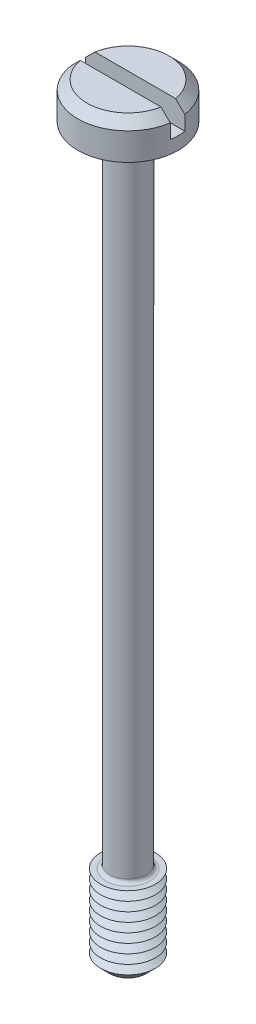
SolidWorks part; units mm, degrees
ref_plane "Front Plane" through (0, 0, 0) normal (0, 0, 1) x (1, 0, 0)
ref_plane "Top Plane" through (0, 0, 0) normal (0, 1, 0) x (1, 0, 0)
ref_plane "Right Plane" through (0, 0, 0) normal (1, 0, 0) x (0, 0, -1)
sketch "Sketch1" plane through (0, 0, 0) normal (0, 1, 0) x (1, 0, 0)
  circle A0 centre (0, 0) radius 2.75
  dimension "D1" = 5.5
extrude "Boss-Extrude1" add sketch "Sketch1" along normal blind 2
sketch "Sketch2" plane through (0, 0, 0) normal (0, -1, 0) x (1, 0, 0)
  circle A0 centre (0, 0) radius 1
  dimension "D1" = 2
extrude "Boss-Extrude2" add sketch "Sketch2" along normal blind 40
sketch "Sketch3" plane through (0, -40, 0) normal (0, -1, 0) x (1, 0, 0)
  circle A0 centre (0, 0) radius 1.5
  dimension "D1" = 3
extrude "Boss-Extrude3" add sketch "Sketch3" against normal blind 4.5
chamfer "Chamfer1" distance 0.5 angle 45 1 edges at (0, -40, -1.5)
sketch "Sketch4" plane through (0, 0, 0) normal (1, 0, 0) x (0, 0, -1)
  line L0 (0, -6.5871) -> (0, -12.0372) construction
sketch "Sketch5" plane through (0, 0, 0) normal (1, 0, 0) x (0, 0, -1)
  line L0 (-1.5, -35.5) -> (-1.067, -35.75)
  line L1 (-1.067, -35.75) -> (-1.5, -36)
  line L2 (-1.5, -35.5) -> (-1.5, -39.5) construction
  line L3 (-1.5, -36) -> (-1.5, -35.5)
  dimension "D1" = 0.5
revolve "Cut-Revolve1" cut sketch "Sketch5" angle 360 about L0
pattern_linear "LPattern1" count 8 spacing 0.5 along (0, -1, 0) of "Cut-Revolve1"
fillet "Fillet1" radius 0.2 2 edges at (0, -35.5, -1) (0, 0, -1)
chamfer "Chamfer2" distance 0.5 angle 45 1 edges at (0, 2, 2.75)
sketch "Sketch6" plane through (0, 2, 0) normal (0, 1, 0) x (1, 0, 0)
  line L1 (2.75, -0.4) -> (-2.75, -0.4)
  line L2 (2.75, -0.4) -> (2.75, 0.4)
  line L3 (2.75, 0.4) -> (-2.75, 0.4)
  line L4 (-2.75, -0.4) -> (-2.75, 0.4)
  line L5 (2.75, -0.4) -> (-2.75, 0.4) construction
  line L6 (2.75, 0.4) -> (-2.75, -0.4) construction
  circle A0 centre (0, 0) radius 2.75 construction
  point P0 (0, 0)
  dimension "D1" = 0.8
extrude "Cut-Extrude1" cut sketch "Sketch6" against normal blind 1.3
